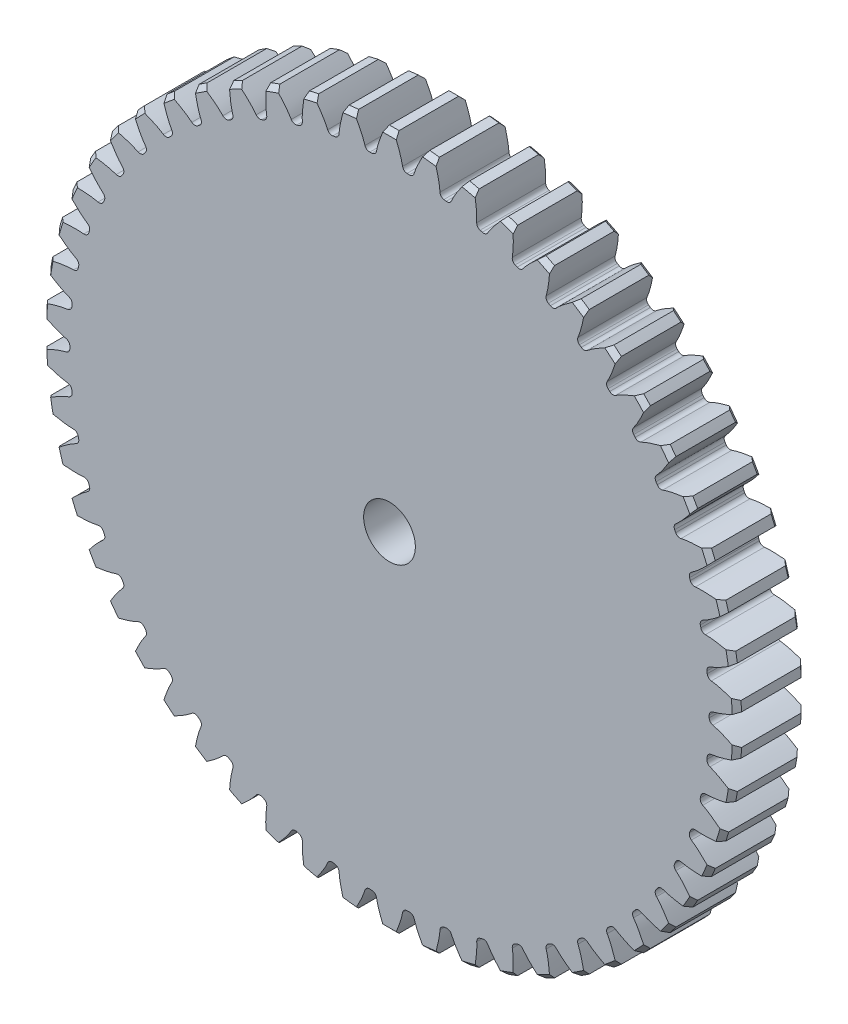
SolidWorks part; units mm, degrees
ref_plane "Face" through (0, 0, 0) normal (0, 0, 1) x (1, 0, 0)
ref_plane "Dessus" through (0, 0, 0) normal (0, 1, 0) x (1, 0, 0)
ref_plane "Droite" through (0, 0, 0) normal (1, 0, 0) x (0, 0, -1)
sketch "Dent" plane through (0, 0, 0) normal (0, 0, 1) x (1, 0, 0)
  line L1 (-0.1404, 8.1709) -> (0, 7.7851)
  line L3 (0, 10.08) -> (0, -10.08) construction
  line L4 (0, 0) -> (0.1404, 10.079) construction
  line L5 (0.2827, 9.7159) -> (-0.2827, 9.7159) construction
  line L6 (0.4017, 9.125) -> (-0.4017, 9.125) construction
  line L7 (-0.18, 0) -> (0.18, 0) construction
  line L9 (0.1404, 8.1709) -> (0, 7.7851)
  line L11 (0, 0) -> (0.2827, 9.7159) construction
  line L12 (0, 0) -> (0.4017, 9.125) construction
  circle A0 centre (0, 0) radius 9.72 construction
  circle A1 centre (0, 0) radius 10.08 construction
  arc A2 (0.1404, 10.079) -> (-0.1404, 10.079) centre (0, 0) ccw
  circle A3 centre (0, 0) radius 9.1338 construction
  point P2 (-0.2827, 9.7159)
  point P3 (-0.4017, 9.125)
  point P19 (0.2827, 9.7159)
  point P20 (0.4017, 9.125)
  dimension "Dp" = 19.44
  dimension "Dt" = 20.16
  dimension "Db" = 18.2676
  dimension "Module" = 0.36
  dimension "Angle de pression" = 20
  dimension "Ep au primitif" = 0.5655
  dimension "D3" = 1.723
  dimension "D4" = 0.854
sketch "Esquisse2" plane through (0, 0, 0) normal (0, 0, 1) x (1, 0, 0)
  circle A0 centre (0, 0) radius 9.27
  dimension "Dpied" = 18.54
extrude "Base-Extrusion" add sketch "Esquisse2" against normal mid plane 2
extrude "Boss.-Extru.1" add sketch "Dent" against normal mid plane 2
fillet "Congé1" radius 0.1368 4 edges at (0.3944, 9.2616, 0) (-0.3946, 9.2616, 0)
chamfer "Chanfrein1" distance 0.1368 angle 45 4 edges at (0, 10.08, -1) (0, 10.08, 1)
pattern_circular "Répétition circulaire1" count 54 over 360 of "Congé1", "Boss.-Extru.1", "Chanfrein1"
sketch "Esquisse3" plane through (0, 0, -1) normal (0, 0, -1) x (-1, 0, 0)
  circle A0 centre (0, 0) radius 1.25
  dimension "D1" = 2.5
extrude "Boss.-Extru.2" add sketch "Esquisse3" along normal blind 0.5
sketch "Esquisse4" plane through (0, 0, 1) normal (0, 0, 1) x (1, 0, 0)
  circle A0 centre (0, 0) radius 0.75
  dimension "D1" = 1.5
extrude "Enlèv. mat.-Extru.1" cut sketch "Esquisse4" against normal up to next
sketch "Diamètre primitif roue" plane through (0, 0, 0) normal (0, 0, 1) x (1, 0, 0)
  circle A0 centre (0, 0) radius 9.72
  dimension "D1" = 19.44
